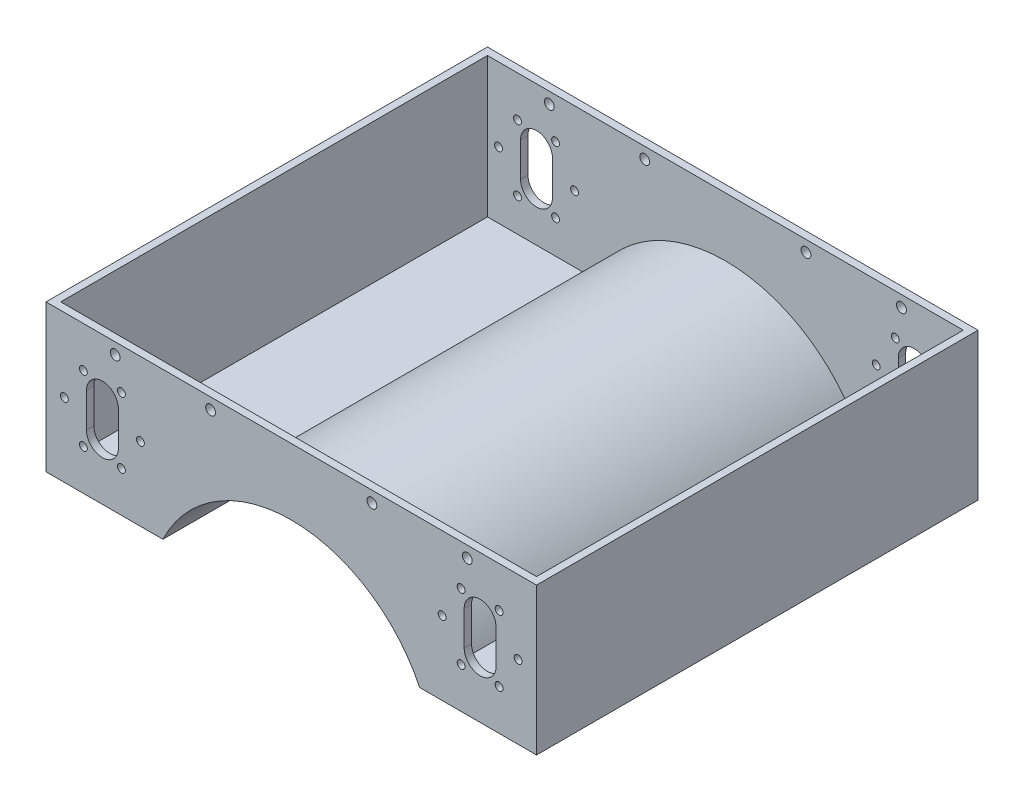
SolidWorks part; units mm, degrees
ref_plane "前视基准面" through (0, 0, 0) normal (0, 0, 1) x (1, 0, 0)
ref_plane "上视基准面" through (0, 0, 0) normal (0, 1, 0) x (1, 0, 0)
ref_plane "右视基准面" through (0, 0, 0) normal (1, 0, 0) x (0, 0, -1)
sketch "草图2" plane through (0, 0, 0) normal (0, 1, 0) x (1, 0, 0)
  line L1 (-100, 90) -> (100, 90)
  line L2 (-100, 90) -> (-100, -90)
  line L3 (-100, -90) -> (100, -90)
  line L4 (100, 90) -> (100, -90)
  line L5 (-100, 90) -> (100, -90) construction
  line L6 (-100, -90) -> (100, 90) construction
  point P0 (0, 0)
  dimension "D1" = 200
  dimension "D2" = 180
extrude "凸台-拉伸1" add sketch "草图2" along normal blind 60
sketch "草图6" plane through (0, 0, 90) normal (0, 0, 1) x (1, 0, 0)
  circle A0 centre (0, -25) radius 58
  dimension "D1" = 25
extrude "切除-拉伸2" cut sketch "草图6" against normal blind 1000
shell "抽壳1" thickness 3
sketch "草图10" plane through (0, 0, 90) normal (0, 0, 1) x (1, 0, 0)
  line L0 (-83.5, 37) -> (-83.5, 23)
  line L1 (-70.5001, 36.9662) -> (-70.5, 23.0004)
  line L2 (0, -72.7828) -> (0, 72.7828) construction
  line L3 (70.5001, 36.9662) -> (70.5, 23.0004)
  line L4 (83.5, 37) -> (83.5, 23)
  circle A0 centre (-84.75, 43.4234) radius 1.6
  circle A1 centre (-69.25, 43.4234) radius 1.6
  circle A2 centre (-61.5, 30) radius 1.6
  circle A3 centre (-69.25, 16.5766) radius 1.6
  circle A4 centre (-84.75, 16.5766) radius 1.6
  circle A5 centre (-92.5, 30) radius 1.6
  arc A8 (-70.5, 37) -> (-83.5, 37) centre (-77, 37) ccw construction
  arc A9 (-70.5001, 36.9662) -> (-83.5, 37) centre (-77, 37) ccw
  arc A10 (-83.5, 23) -> (-70.5, 23.0004) centre (-77, 23) ccw
  arc A11 (83.5, 23) -> (70.5, 23.0004) centre (77, 23) cw
  arc A12 (70.5001, 36.9662) -> (83.5, 37) centre (77, 37) cw
  circle A13 centre (92.5, 30) radius 1.6
  circle A14 centre (84.75, 16.5766) radius 1.6
  circle A15 centre (69.25, 16.5766) radius 1.6
  circle A16 centre (61.5, 30) radius 1.6
  circle A17 centre (69.25, 43.4234) radius 1.6
  circle A18 centre (84.75, 43.4234) radius 1.6
extrude "切除-拉伸5" cut sketch "草图10" against normal blind 1000
sketch "草图11" plane through (0, 0, 90) normal (0, 0, 1) x (1, 0, 0)
  circle A0 centre (-71.7935, 55.4156) radius 2
  circle A1 centre (-32.8832, 55.4156) radius 2
extrude "切除-拉伸6" cut sketch "草图11" against normal blind 10
mirror "镜向1" about plane through (0, 0, 0) normal (1, 0, 0) of "切除-拉伸6"
mirror "镜向2" about plane through (0, 0, 0) normal (0, 0, 1) of "镜向1", "切除-拉伸6"
